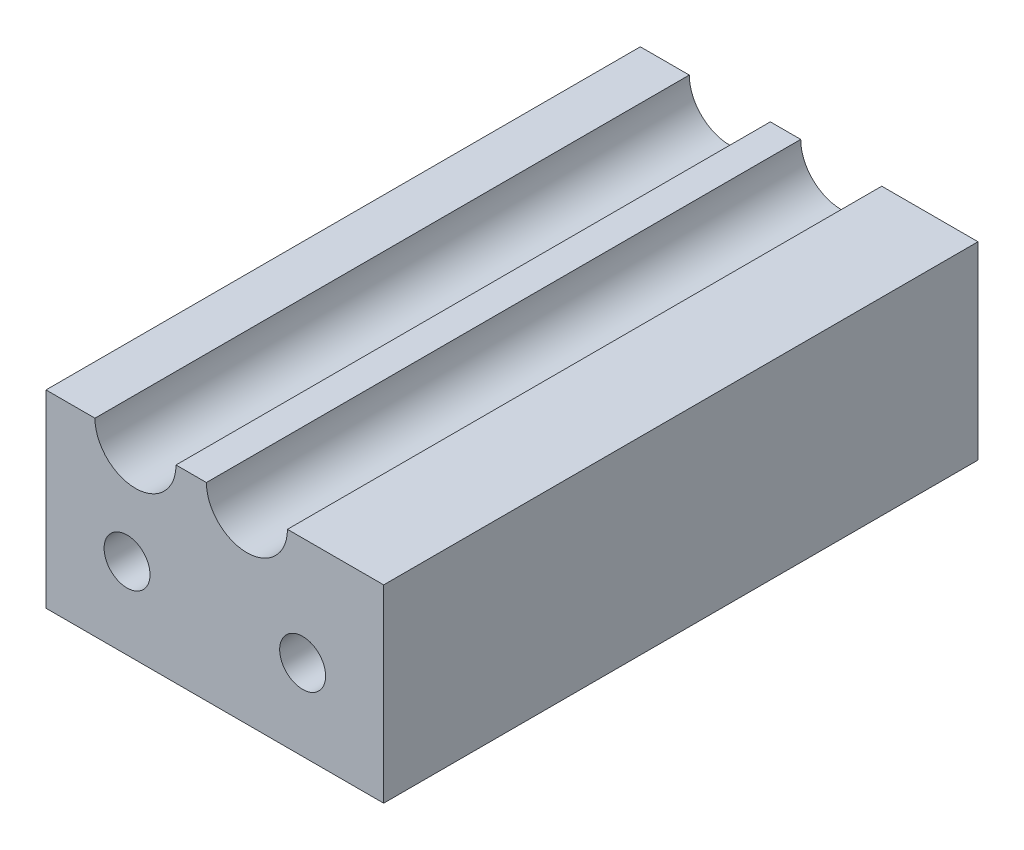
SolidWorks part; units mm, degrees
ref_plane "Frontal" through (0, 0, 0) normal (0, 0, 1) x (1, 0, 0)
ref_plane "Horizontal" through (0, 0, 0) normal (0, 1, 0) x (1, 0, 0)
ref_plane "Profil" through (0, 0, 0) normal (1, 0, 0) x (0, 0, -1)
sketch "Esquisse1" plane through (0, 0, 0) normal (0, 0, 1) x (1, 0, 0)
  line L0 (-299, -176.5) -> (-249, -176.5) construction
  line L1 (-249, -176.5) -> (-249, -148.5) construction
  line L2 (-249, -148.5) -> (-263.25, -148.5) construction
  line L3 (-275.25, -148.5) -> (-279.75, -148.5) construction
  line L4 (-291.75, -148.5) -> (-299, -148.5) construction
  line L5 (-299, -148.5) -> (-299, -176.5) construction
  line L6 (-299, -176.5) -> (-249, -176.5)
  line L7 (-249, -176.5) -> (-249, -148.5)
  line L8 (-249, -148.5) -> (-263.25, -148.5)
  line L9 (-275.25, -148.5) -> (-279.75, -148.5)
  line L10 (-291.75, -148.5) -> (-299, -148.5)
  line L11 (-299, -148.5) -> (-299, -176.5)
  arc A0 (-275.25, -148.5) -> (-263.25, -148.5) centre (-269.25, -148.5) ccw construction
  arc A1 (-291.75, -148.5) -> (-279.75, -148.5) centre (-285.75, -148.5) ccw construction
  arc A2 (-275.25, -148.5) -> (-263.25, -148.5) centre (-269.25, -148.5) ccw
  arc A3 (-291.75, -148.5) -> (-279.75, -148.5) centre (-285.75, -148.5) ccw
extrude "Base-Extrusion" add sketch "Esquisse1" against normal blind 88
hole_wizard "Trou taraudé M8x1.252" positions "Esquisse5" profile "Esquisse4" tap size "M8x1.25" standard "Ansi Métrique"
sketch "Esquisse5" plane through (0, 0, 0) normal (0, 0, 1) x (1, 0, 0)
  line L0 (-249, -176.5) -> (-249, -148.5) construction
  line L1 (-299, -176.5) -> (-249, -176.5) construction
  line L2 (-299, -148.5) -> (-299, -176.5) construction
  point P0 (-261, -164.5)
  point P1 (-287, -164.5)
  dimension "D1" = 12
  dimension "D2" = 12
  dimension "D3" = 12
sketch "Esquisse4" plane through (-261, -164.5, 0) normal (1, 0, 0) x (0, -1, 0)
  line L0 (0, 0) -> (0, 32.0429)
  line L1 (0, 32.0429) -> (3.4, 30)
  line L2 (3.4, 30) -> (3.4, 0)
  line L5 (3.4, 0) -> (0, 0)
  line L10 (0, 32.0429) -> (-3.4, 30) construction
  line L11 (0, -6.35) -> (0, 107.95) construction
  dimension "Diamètre du perçage" = 6.8
  dimension "Profondeur du perçage" = 30
  dimension "Angle de pointe" = 118
sketch "Esquisse6" plane through (0, 0, 0) normal (0, 0, 1) x (1, 0, 0)
  line L1 (-279.75, -148.5) -> (-275.25, -148.5)
  line L2 (-279.75, -148.5) -> (-279.75, -142.6005)
  line L4 (-275.25, -148.5) -> (-275.25, -142.6005)
  arc A0 (-279.75, -142.6005) -> (-275.25, -142.6005) centre (-277.5, -142.6005) cw
  arc A1 (-275.25, -148.5) -> (-263.25, -148.5) centre (-269.25, -148.5) ccw construction
  dimension "D1" = 2.25
  dimension "D2" = 5.8995
extrude "Extrusion2" add sketch "Esquisse6" against normal up to vertex
